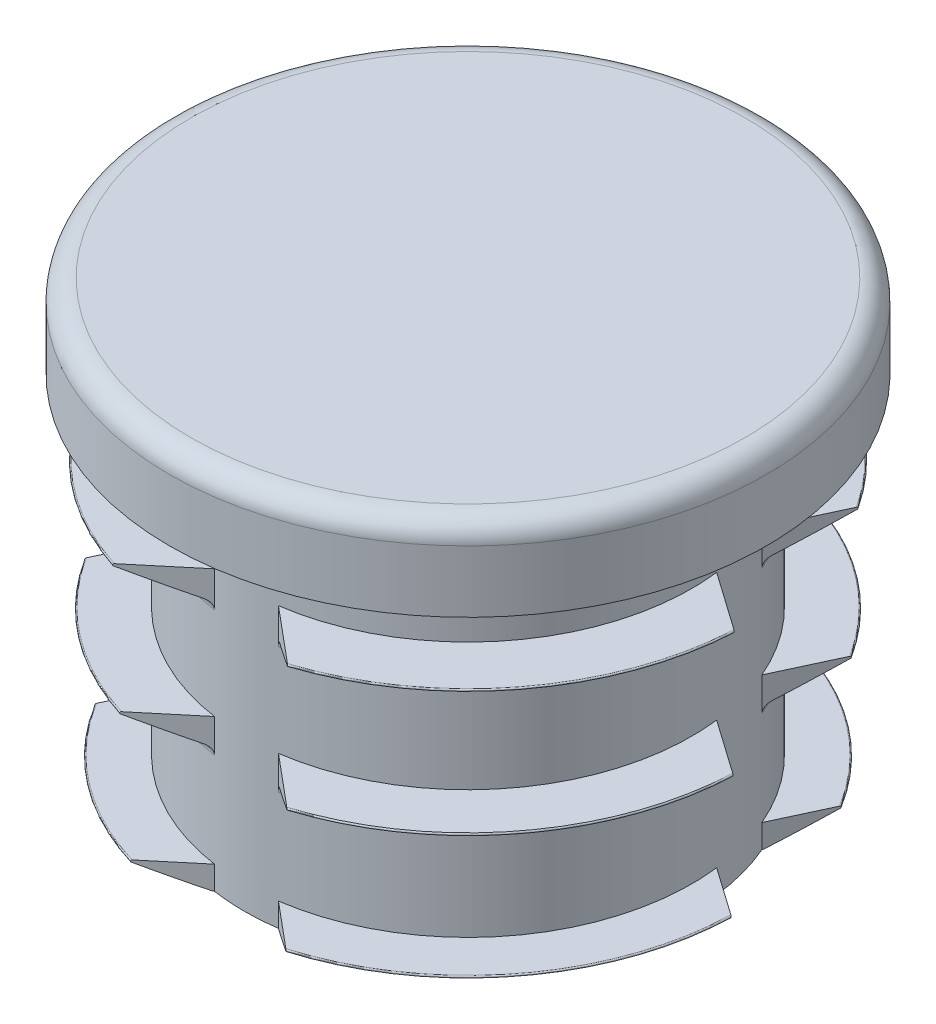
SolidWorks part; units mm, degrees
ref_plane "Спереди" through (0, 0, 0) normal (0, 0, 1) x (1, 0, 0)
ref_plane "Сверху" through (0, 0, 0) normal (0, 1, 0) x (1, 0, 0)
ref_plane "Справа" through (0, 0, 0) normal (1, 0, 0) x (0, 0, -1)
sketch "Эскиз1" plane through (0, 0, 0) normal (0, 1, 0) x (1, 0, 0)
  circle A0 centre (0, 0) radius 14
  dimension "D1" = 28
extrude "Бобышка-Вытянуть1" add sketch "Эскиз1" along normal mid plane 3.9
sketch "Эскиз2" plane through (0, -1.95, 0) normal (0, -1, 0) x (1, 0, 0)
  circle A0 centre (0, 0) radius 10.5
  circle A1 centre (0, 0) radius 8.5
  dimension "D1" = 21
  dimension "D2" = 2
extrude "Бобышка-Вытянуть2" add sketch "Эскиз2" along normal blind 16.6
sketch "Эскиз3" plane through (0, 0, 0) normal (1, 0, 0) x (0, 0, -1)
  line L0 (0, -17.4309) -> (-22.197, -17.4309) construction
  line L1 (0, -18.55) -> (0, -1.95) construction
  line L3 (-10.5, -1.95) -> (-10.5, -18.55) construction
  line L5 (0, -18.55) -> (0, -1.95) construction
  line L6 (-12.9, -17.4309) -> (-10.5, -18.55)
  line L7 (-10.5, -18.55) -> (10.5, -18.55) construction
  line L8 (-10.5, -1.95) -> (10.5, -1.95) construction
  line L9 (0, -11.4309) -> (-23.9417, -11.4309) construction
  line L13 (0, -5.4309) -> (-23.5618, -5.4309) construction
  line L19 (-13.4, -5.4309) -> (-10.5, -6.7832)
  line L22 (-13.2, -11.4309) -> (-10.5, -12.6899)
  line L23 (-13.4, -5.4309) -> (-10.5, -5.4309)
  line L24 (-10.5, -5.4309) -> (-10.5, -6.7832)
  line L25 (-13.2, -11.4309) -> (-10.5, -11.4309)
  line L26 (-10.5, -11.4309) -> (-10.5, -12.6899)
  line L27 (-10.5, -18.55) -> (-10.5, -17.4309)
  line L28 (-10.5, -17.4309) -> (-12.9, -17.4309)
  point P12 (-10.5, -17.4309)
  point P28 (-10.5, -11.4309)
  point P29 (-10.5, -5.4309)
revolve "Повернуть1" add sketch "Эскиз3" angle 360 about L5
fillet "Скругление1" radius 1 1 edges at (0, 1.95, 14)
fillet "Скругление2" radius 0.05 3 edges at (0, -17.4309, -12.9) (0, -11.4309, -13.2) (0, -5.4309, -13.4)
fillet "Скругление3" radius 0.5 3 edges at (0, -18.55, -10.5) (0, -6.7832, 10.5) (0, -12.6899, 10.5)
sketch "Эскиз4" plane through (0, -18.55, 0) normal (0, -1, 0) x (1, 0, 0)
  line L0 (0, 9.5828) -> (0, 16.6568) construction
  line L1 (-1.5, 10.3923) -> (-13, 20)
  line L2 (-13, 20) -> (13, 20)
  line L3 (1.5, 10.3923) -> (13, 20)
  arc A0 (1.5, 10.3923) -> (-1.5, 10.3923) centre (0, 0) ccw
  point P9 (0, 20)
  dimension "D2" = 20
  dimension "D3" = 10.5
  dimension "D1" = 26
  dimension "D4" = 3
extrude "Вырез-Вытянуть1" cut sketch "Эскиз4" against normal up to surface (16.6 mm away)
pattern_circular "Круговой массив1" count 2 every 75 about axis through (0, 0, 0) along (0, 1, 0) of "Вырез-Вытянуть1"
pattern_circular "Круговой массив2" count 2 every 180 about axis through (0, 0, 0) along (0, 1, 0) of "Круговой массив1", "Вырез-Вытянуть1"
equation "\"D4@Эскиз3\"=25.8/2"
equation "\"D6@Эскиз3\"=\"D5@Эскиз3\""
equation "\"D7@Эскиз3\"=\"D2@Эскиз3\""
equation "\"D1@Эскиз3\"=\"D2@Эскиз3\""
